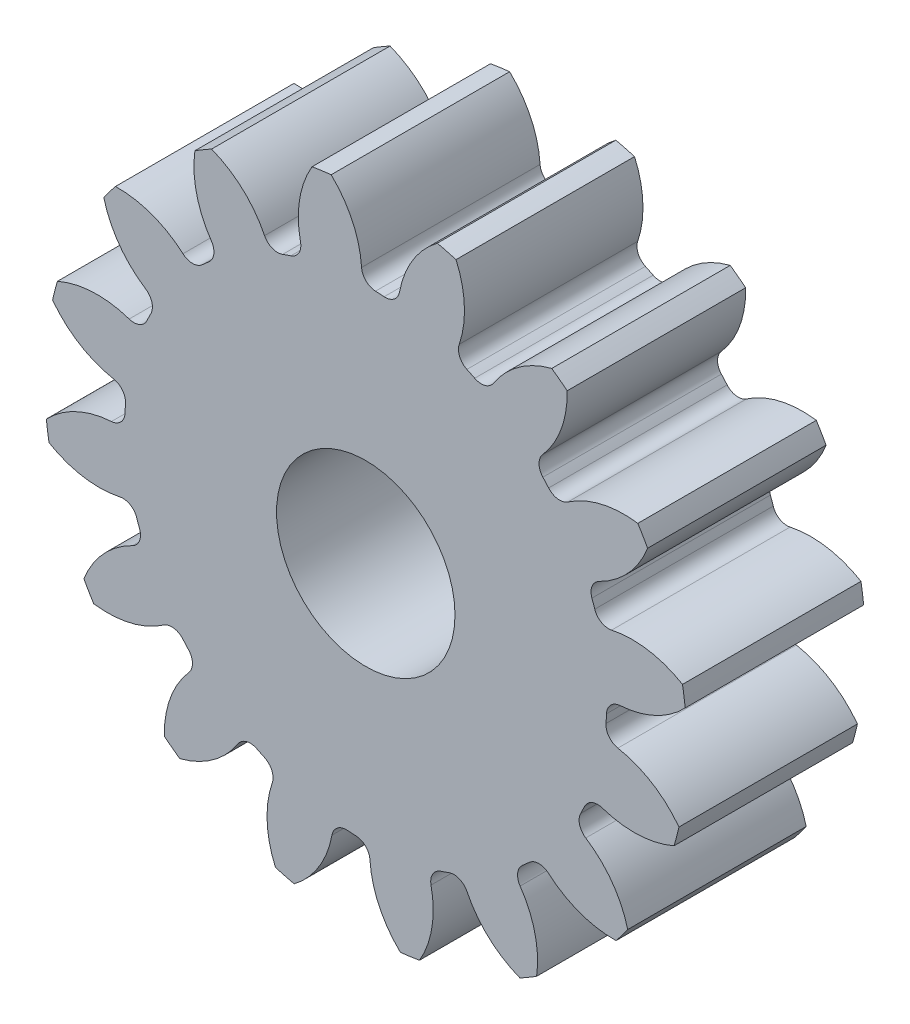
SolidWorks part; units mm, degrees
ref_plane "Front" through (0, 0, 0) normal (0, 0, 1) x (1, 0, 0)
ref_plane "Top" through (0, 0, 0) normal (0, 1, 0) x (1, 0, 0)
ref_plane "Right" through (0, 0, 0) normal (1, 0, 0) x (0, 0, -1)
sketch "Sketch3" plane through (0, 0, 0) normal (0, 0, 1) x (1, 0, 0)
  circle A0 centre (0, 0) radius 182.88
  dimension "od" = 365.76
extrude "gearBody" add sketch "Sketch3" along normal blind 101.6
sketch "Sketch2" plane through (0, 0, 0) normal (0, 0, 1) x (1, 0, 0)
  line L0 (0, 0) -> (141.1285, 58.4574) construction
  line L1 (179.2049, -42.0089) -> (0, 0) construction
  line L2 (0, 0) -> (36.3143, 0) construction
  line L3 (162.432, 6.4488) -> (160.5731, -25.3387) construction
  line L5 (161.5025, -9.4449) -> (0, 0) construction
  line L7 (0, 0) -> (152.7564, 0) construction
  arc A0 (152.7172, 3.4625) -> (151.2725, -21.2403) centre (0, 0) ccw construction
  arc A1 (181.8173, 19.6868) -> (178.2831, -40.7461) centre (0, 0) ccw construction
  arc A2 (162.432, 6.4488) -> (160.5731, -25.3387) centre (0, 0) ccw construction
  arc A3 (136.76, -10.4675) -> (137.0479, -5.5452) centre (0, 0) ccw
  arc A4 (179.2049, -42.0089) -> (143.5112, -19.2326) centre (133.3524, -74.5094) ccw
  arc A5 (179.2049, -42.0089) -> (182.88, 20.8337) centre (0, 0) ccw
  arc A6 (182.88, 20.8337) -> (144.7748, 2.3732) centre (141.1285, 58.4574) cw
  arc A7 (137.0479, -5.5452) -> (144.7748, 2.3732) centre (145.3113, -5.8796) cw
  arc A8 (143.5112, -19.2326) -> (136.76, -10.4675) centre (145.0061, -11.0986) cw
  point P6 (182.88, 20.8337)
  point P22 (179.2049, -42.0089)
  dimension "baseDia" = 305.5129
  dimension "od" = 365.76
  dimension "pd" = 325.12
  dimension "rd" = 274.32
  dimension "rFillet" = 8.2702
  dimension "pointX" = 182.88
  dimension "pointY" = 20.8337
  dimension "CTT" = 31.7875
  dimension "flankCenterAngle" = 22.5
extrude "toothCut" cut sketch "Sketch2" along normal through all
pattern_circular "CirPattern1" count 16 over 360 about axis through (0, 0, 0) along (0, 0, 1) of "toothCut"
sketch "hub1Dia" plane through (0, 0, 0) normal (0, 0, -1) x (-1, 0, 0)
  circle A0 centre (0, 0) radius 12.7
  dimension "hub1Dia" = 25.4
sketch "hub2Dia" plane through (0, 0, 101.6) normal (0, 0, 1) x (1, 0, 0)
  circle A0 centre (0, 0) radius 12.7
  dimension "hub2dia" = 25.4
sketch "boreDia" plane through (0, 0, 0) normal (0, 0, 1) x (1, 0, 0)
  circle A0 centre (0, 0) radius 50.8
  dimension "boreDia" = 101.6
extrude "bore" cut sketch "boreDia" against normal mid plane 25400
